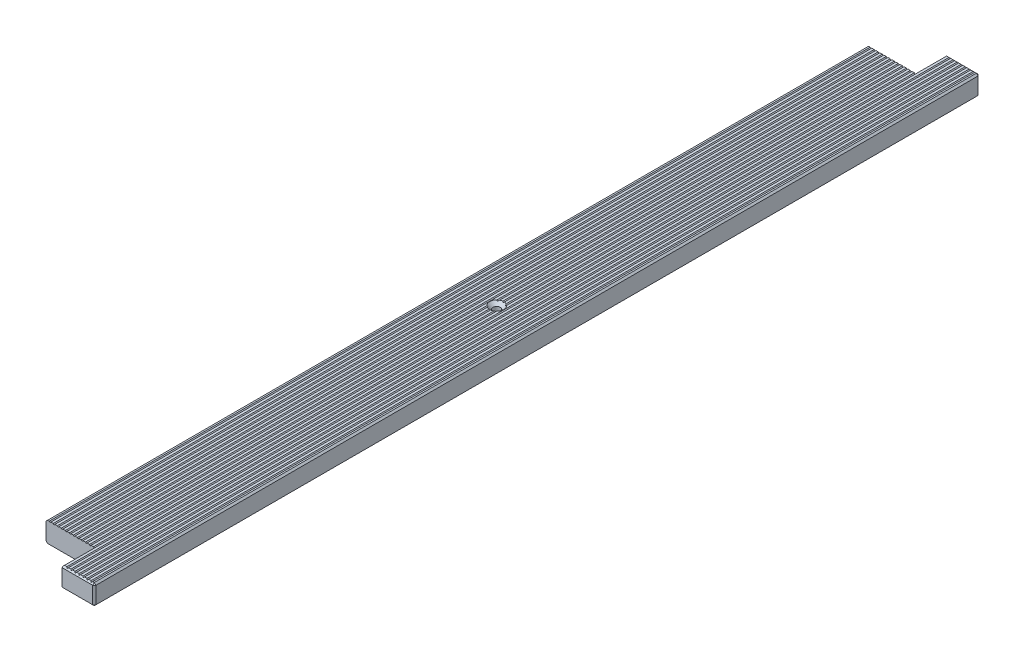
SolidWorks part; units mm, degrees
ref_plane "Plan de face" through (0, 0, 0) normal (0, 0, 1) x (1, 0, 0)
ref_plane "Plan de dessus" through (0, 0, 0) normal (0, 1, 0) x (1, 0, 0)
ref_plane "Plan de droite" through (0, 0, 0) normal (1, 0, 0) x (0, 0, -1)
sketch "Esquisse1" plane through (0, 0, 0) normal (0, 0, 1) x (1, 0, 0)
  line L0 (50, -12.5) -> (-50, 12.5) construction
  line L2 (50, -12.5) -> (-50, -12.5)
  line L3 (50, -12.5) -> (50, 12.5)
  line L4 (50, 12.5) -> (-50, 12.5)
  line L5 (-50, -12.5) -> (-50, 12.5)
  dimension "D1" = 25
  dimension "D2" = 100
extrude "Boss.-Extru.1" add sketch "Esquisse1" along normal mid plane 1100
chamfer "Chanfrein1" distance 2 angle 45 12 edges at (-50, 0, -550) (50, 0, -550) (-50, -12.5, 0) (0, -12.5, -550) (50, -12.5, 0) (0, -12.5, 550) (-50, 0, 550) (50, 0, 550) (50, 12.5, 0) (0, 12.5, 550) (-50, 12.5, 0) (0, 12.5, -550)
sketch "Esquisse2" plane through (0, 0, 550) normal (0, 0, 1) x (1, 0, 0)
  line L0 (-45, 25.2323) -> (-45, -21.4574) construction
  line L1 (-48, 12.5) -> (48, 12.5) construction
  line L2 (-46, 12.5) -> (-44, 12.5)
  line L3 (-46, 12.5) -> (-45, 11.5)
  line L4 (-45, 11.5) -> (-44, 12.5)
  dimension "D1" = 90
  dimension "D2" = 1
  dimension "D3" = 45
extrude "Enlèv. mat.-Extru.1" cut sketch "Esquisse2" against normal through all
pattern_linear "Répétition linéaire1" count 19 spacing 5 along (1, 0, 0) of "Enlèv. mat.-Extru.1"
hole_wizard "Fraisage pour vis à tête fraisée M81" positions "Esquisse4" profile "Esquisse3" countersink size "M8" standard "ISO"
sketch "Esquisse4" plane through (0, 12.5, 0) normal (0, 1, 0) x (-1, 0, 0)
  line L0 (48, -550) -> (-48, -550) construction
  line L2 (0, -598.1763) -> (0, 635.096) construction
  line L3 (0, -549) -> (0, 549) construction
  line L6 (-48, 550) -> (48, 550) construction
  point P0 (0, -520)
  point P19 (0, 0)
  point P21 (0, 520)
  dimension "D1" = 30
  dimension "D2" = 30
sketch "Esquisse3" plane through (0, 12.5, -520) normal (1, 0, 0) x (0, 0, 1)
  line L0 (0, 0) -> (0, 25)
  line L1 (0, 25) -> (4.5, 25)
  line L2 (4.5, 25) -> (4.5, 4.15)
  line L3 (4.5, 4.15) -> (8.65, 0)
  line L5 (8.65, 0) -> (0, 0)
  line L6 (-4.5, 4.15) -> (-8.65, 0) construction
  line L11 (0, -6.35) -> (0, 107.95) construction
  dimension "Diamètre du perçage jusqu'au prochain" = 9
  dimension "Profondeur du perçage jusqu'au prochain" = 25
  dimension "Diamètre du fraisage entrant" = 17.3
  dimension "Angle du fraisage entrant" = 90
sketch "Esquisse5" plane through (0, 12.5, 0) normal (0, 1, 0) x (1, 0, 0)
  line L1 (10, -510) -> (-50, -510)
  line L2 (10, -510) -> (10, -550)
  line L3 (10, -550) -> (-50, -550)
  line L4 (-50, -510) -> (-50, -550)
  line L5 (48, -550) -> (-48, -550) construction
  line L6 (-48, 550) -> (48, 550) construction
  line L7 (-50, 510) -> (10, 510)
  line L8 (-50, 510) -> (-50, 550)
  line L9 (-50, 550) -> (10, 550)
  line L10 (10, 510) -> (10, 550)
  line L11 (-50, -548) -> (-50, 548) construction
  dimension "D1" = 40
  dimension "D2" = 60
  dimension "D3" = 40
  dimension "D4" = 60
extrude "Enlèv. mat.-Extru.2" cut sketch "Esquisse5" against normal through all
